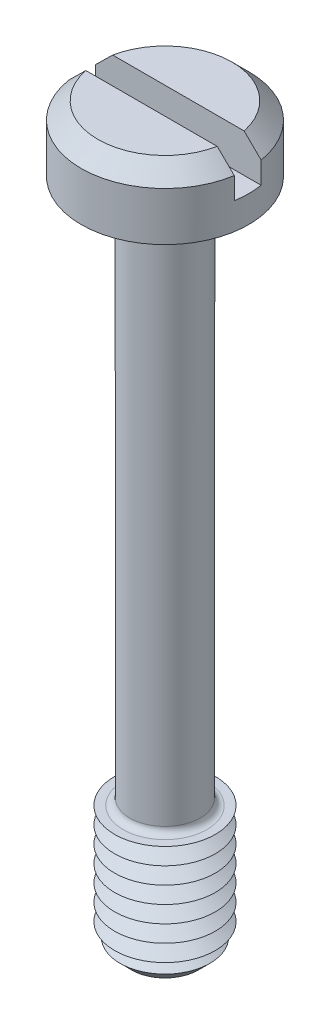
SolidWorks part; units mm, degrees
ref_plane "Front Plane" through (0, 0, 0) normal (0, 0, 1) x (1, 0, 0)
ref_plane "Top Plane" through (0, 0, 0) normal (0, 1, 0) x (1, 0, 0)
ref_plane "Right Plane" through (0, 0, 0) normal (1, 0, 0) x (0, 0, -1)
sketch "Sketch1" plane through (0, 0, 0) normal (0, 1, 0) x (1, 0, 0)
  circle A0 centre (0, 0) radius 5
  dimension "D1" = 10
extrude "Boss-Extrude1" add sketch "Sketch1" along normal blind 3.9
sketch "Sketch2" plane through (0, 0, 0) normal (0, -1, 0) x (1, 0, 0)
  circle A0 centre (0, 0) radius 2.1
  dimension "D1" = 4.2
extrude "Boss-Extrude2" add sketch "Sketch2" along normal blind 40
sketch "Sketch3" plane through (0, -40, 0) normal (0, -1, 0) x (1, 0, 0)
  circle A0 centre (0, 0) radius 3
  dimension "D1" = 6
extrude "Boss-Extrude3" add sketch "Sketch3" against normal blind 7.5
chamfer "Chamfer1" distance 1 angle 45 1 edges at (0, -40, -3)
sketch "Sketch4" plane through (0, 0, 0) normal (1, 0, 0) x (0, 0, -1)
  line L0 (0, -6.5871) -> (0, -12.0372) construction
sketch "Sketch5" plane through (0, 0, 0) normal (1, 0, 0) x (0, 0, -1)
  line L0 (-3, -32.5) -> (-2.134, -33)
  line L1 (-2.134, -33) -> (-3, -33.5)
  line L2 (-3, -32.5) -> (-3, -39) construction
  line L3 (-3, -33.5) -> (-3, -32.5)
  dimension "D1" = 1
revolve "Cut-Revolve1" cut sketch "Sketch5" angle 360 about L0
pattern_linear "LPattern1" count 7 spacing 1 along (0, -1, 0) of "Cut-Revolve1"
fillet "Fillet1" radius 0.4 2 edges at (0, -32.5, -2.1) (0, 0, -2.1)
chamfer "Chamfer2" distance 1 angle 45 1 edges at (0, 3.9, 5)
sketch "Sketch6" plane through (0, 3.9, 0) normal (0, 1, 0) x (1, 0, 0)
  line L1 (5, -0.8) -> (-5, -0.8)
  line L2 (5, -0.8) -> (5, 0.8)
  line L3 (5, 0.8) -> (-5, 0.8)
  line L4 (-5, -0.8) -> (-5, 0.8)
  line L5 (5, -0.8) -> (-5, 0.8) construction
  line L6 (5, 0.8) -> (-5, -0.8) construction
  circle A0 centre (0, 0) radius 5 construction
  point P0 (0, 0)
  dimension "D1" = 1.6
extrude "Cut-Extrude1" cut sketch "Sketch6" against normal blind 2.3
